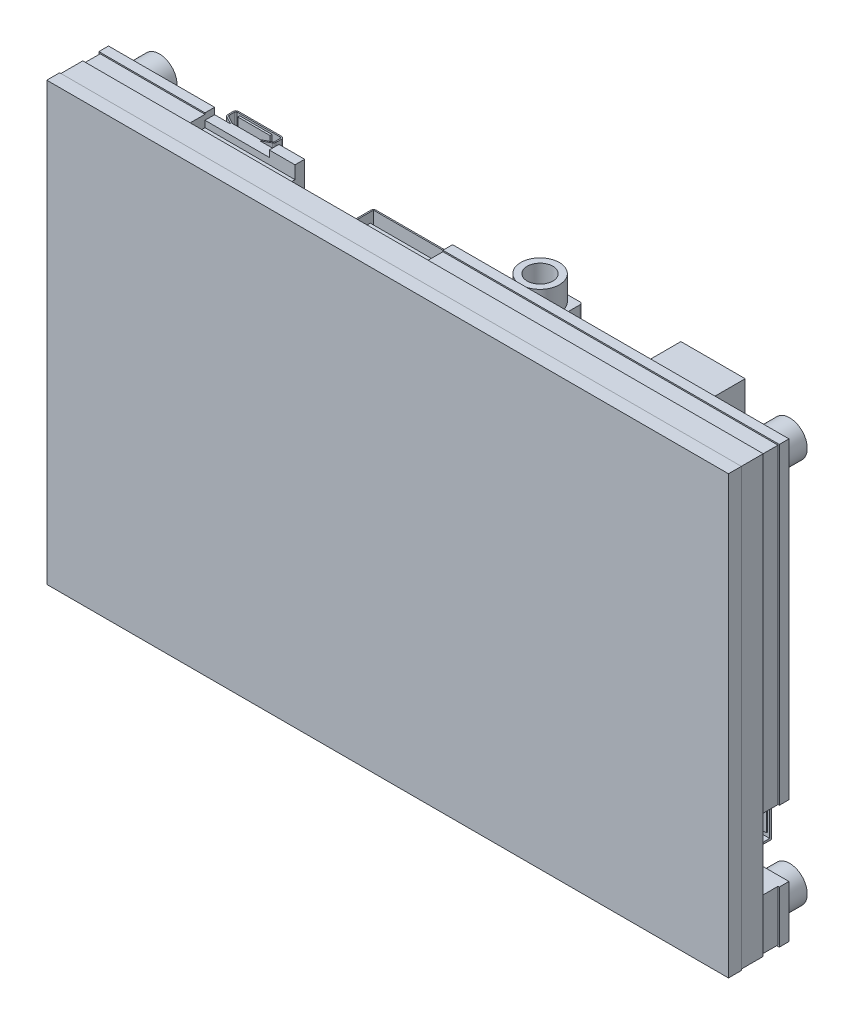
SolidWorks part; units mm, degrees
ref_plane "Front Plane" through (0, 0, 0) normal (0, 0, 1) x (1, 0, 0)
ref_plane "Top Plane" through (0, 0, 0) normal (0, 1, 0) x (1, 0, 0)
ref_plane "Right Plane" through (0, 0, 0) normal (1, 0, 0) x (0, 0, -1)
sketch "Esquisse1" plane through (0, 0, 0) normal (0, 0, 1) x (1, 0, 0)
  line L1 (-53, -33.95) -> (53, -33.95)
  line L2 (-53, -33.95) -> (-53, 33.95)
  line L3 (-53, 33.95) -> (53, 33.95)
  line L4 (53, -33.95) -> (53, 33.95)
  line L5 (-53, -33.95) -> (53, 33.95) construction
  line L6 (-53, 33.95) -> (53, -33.95) construction
  point P0 (0, 0)
  dimension "D1" = 106
  dimension "D2" = 67.9
extrude "Boss.-Extru.1" add sketch "Esquisse1" along normal blind 2
sketch "Esquisse2" plane through (0, 0, 0) normal (0, 0, -1) x (-1, 0, 0)
  line L16 (-52.9, 33.85) -> (-52.9, -33.85)
  line L17 (-52.9, -33.85) -> (52.9, -33.85)
  line L18 (52.9, -33.85) -> (52.9, 33.85)
  line L19 (52.9, 33.85) -> (-52.9, 33.85)
  line L20 (-52.9, 33.85) -> (-52.9, -33.85)
  line L21 (-52.9, -33.85) -> (52.9, -33.85)
  line L22 (52.9, -33.85) -> (52.9, 33.85)
  line L23 (52.9, 33.85) -> (-52.9, 33.85)
  dimension "D1" = 0.1
extrude "Boss.-Extru.2" add sketch "Esquisse2" along normal blind 3.5
sketch "Esquisse5" plane through (0, 0, -3.5) normal (0, 0, -1) x (-1, 0, 0)
  line L8 (52.7, 33.65) -> (-52.7, 33.65)
  line L9 (-52.7, 33.65) -> (-52.7, -33.65)
  line L10 (-52.7, -33.65) -> (52.7, -33.65)
  line L11 (52.7, -33.65) -> (52.7, 33.65)
  line L12 (52.7, 33.65) -> (-52.7, 33.65)
  line L13 (-52.7, 33.65) -> (-52.7, -33.65)
  line L14 (-52.7, -33.65) -> (52.7, -33.65)
  line L15 (52.7, -33.65) -> (52.7, 33.65)
  dimension "D1" = 0.2
extrude "Boss.-Extru.3" add sketch "Esquisse5" along normal blind 2.5
sketch "Esquisse6" plane through (0, 0, -6) normal (0, 0, -1) x (-1, 0, 0)
  line L0 (-0.6, 33.85) -> (-52.9, 33.85)
  line L2 (-0.6, 33.85) -> (-0.6, 25.85)
  line L3 (-0.6, 25.85) -> (22.4, 25.85)
  line L4 (52.9, 33.85) -> (-52.9, 33.85) construction
  line L5 (52.9, -33.85) -> (52.9, 33.85) construction
  line L6 (-52.9, 33.85) -> (-52.9, -33.85) construction
  line L7 (-52.9, -33.85) -> (52.9, -33.85) construction
  line L8 (52.9, -33.85) -> (52.9, 33.85)
  line L9 (52.9, 33.85) -> (36.4, 33.85)
  line L10 (-52.9, 33.85) -> (-52.9, -14.75)
  line L11 (-52.9, -33.85) -> (52.9, -33.85)
  line L12 (22.4, 33.85) -> (22.4, 25.85)
  line L13 (-52.9, -25.75) -> (-52.9, -33.85)
  line L14 (-52.9, -14.75) -> (-47.4, -14.75)
  line L16 (-52.9, -25.75) -> (-47.4, -25.75)
  line L17 (-47.4, -14.75) -> (-47.4, -25.75)
  line L18 (26.4, 33.85) -> (22.4, 33.85)
  line L20 (26.4, 33.85) -> (26.4, 32.85)
  line L21 (26.4, 32.85) -> (36.4, 32.85)
  line L22 (36.4, 33.85) -> (36.4, 32.85)
  dimension "D2" = 8
  dimension "D3" = 23
  dimension "D4" = 30.5
  dimension "D5" = 11
  dimension "D6" = 5.5
  dimension "D7" = 8.1
  dimension "D1" = 10
  dimension "D8" = 1
  dimension "D9" = 4
extrude "Boss.-Extru.4" add sketch "Esquisse6" along normal blind 1.5
sketch "Esquisse7" plane through (0, 0, -6) normal (0, 0, -1) x (-1, 0, 0)
  line L0 (-52.7, -25.75) -> (-47.4, -25.75) construction
  line L1 (-47.4, -25.75) -> (-47.4, -14.75) construction
  line L2 (-47.4, -14.75) -> (-52.7, -14.75) construction
  line L3 (-52.7, -14.75) -> (-52.7, -25.75) construction
  line L4 (-0.6, 33.65) -> (-0.6, 25.85) construction
  line L5 (-0.6, 25.85) -> (22.4, 25.85) construction
  line L6 (22.4, 25.85) -> (22.4, 33.65) construction
  line L7 (22.4, 33.65) -> (-0.6, 33.65) construction
  line L8 (-52.7, -25.75) -> (-47.4, -25.75)
  line L9 (-47.4, -25.75) -> (-47.4, -14.75)
  line L10 (-47.4, -14.75) -> (-52.7, -14.75)
  line L11 (-52.7, -14.75) -> (-52.7, -25.75)
  line L12 (-0.6, 33.65) -> (-0.6, 25.85)
  line L13 (-0.6, 25.85) -> (22.4, 25.85)
  line L14 (22.4, 25.85) -> (22.4, 31.85)
  line L15 (36.4, 33.65) -> (-0.6, 33.65)
  line L16 (36.4, 33.65) -> (36.4, 32.85) construction
  line L19 (22.4, 31.85) -> (36.4, 31.85)
  line L20 (36.4, 33.65) -> (36.4, 31.85)
  line L21 (22.4, 33.65) -> (22.4, 25.85) construction
  line L22 (52.7, 33.65) -> (-52.7, 33.65) construction
  line L23 (52.9, 33.85) -> (-52.9, 33.85) construction
  line L24 (36.4, 33.65) -> (26.4, 33.65) construction
  dimension "D1" = 2
extrude "Enlèv. mat.-Extru.1" cut sketch "Esquisse7" against normal up to surface (2.5 mm away)
sketch "Esquisse8" plane through (0, 0, -7.5) normal (0, 0, -1) x (-1, 0, 0)
  line L0 (-52.9, 33.85) -> (-52.9, -33.85) construction
  line L3 (52.9, 33.85) -> (-52.9, 33.85) construction
  circle A0 centre (-49, 30) radius 2.75
  circle A1 centre (49, 30) radius 2.75
  circle A2 centre (38.8, 22.9) radius 2.75
  circle A3 centre (-19.2, 22.9) radius 2.75
  circle A4 centre (-49, -30) radius 2.75
  circle A5 centre (-19.2, -27.1) radius 2.75
  circle A6 centre (38.8, -27.1) radius 2.75
  circle A7 centre (49, -30) radius 2.75
  circle A8 centre (-49, -30) radius 1.25
  circle A9 centre (-19.2, -27.1) radius 1.25
  circle A10 centre (38.8, -27.1) radius 1.25
  circle A11 centre (49, -30) radius 1.25
  circle A12 centre (49, 30) radius 1.25
  circle A13 centre (-19.2, 22.9) radius 1.25
  circle A14 centre (-49, 30) radius 1.25
  circle A15 centre (38.8, 22.9) radius 1.25
  dimension "D1" = 98
  dimension "D2" = 58
  dimension "D3" = 60
  dimension "D4" = 50
  dimension "D6" = 3.85
  dimension "D7" = 10.2
  dimension "D8" = 2.9
  dimension "D9" = 5.5
  dimension "D10" = 2.5
  dimension "D5" = 3.9
extrude "Boss.-Extru.5" add sketch "Esquisse8" along normal blind 4
sketch "Esquisse9" plane through (0, 0, -7.5) normal (0, 0, -1) x (-1, 0, 0)
  line L0 (-0.6, 33.85) -> (-52.9, 33.85) construction
  line L1 (-39.9, 32.35) -> (-29.9, 32.35)
  line L2 (-39.9, 32.35) -> (-39.9, 27.35)
  line L3 (-39.9, 27.35) -> (-29.9, 27.35)
  line L4 (-29.9, 32.35) -> (-29.9, 27.35)
  line L5 (-14.6, 29.85) -> (-7.6, 29.85)
  line L6 (-14.6, 29.85) -> (-14.6, 17.35)
  line L7 (-14.6, 17.35) -> (-7.6, 17.35)
  line L8 (-7.6, 29.85) -> (-7.6, 17.35)
  line L9 (2.9, 26.35) -> (17.9, 26.35)
  line L10 (2.9, 26.35) -> (2.9, 14.85)
  line L11 (2.9, 14.85) -> (17.9, 14.85)
  line L12 (17.9, 26.35) -> (17.9, 14.85)
  line L13 (-52.9, 33.85) -> (-52.9, -14.75) construction
  line L14 (-0.6, 25.85) -> (-0.6, 33.65) construction
  line L15 (22.4, 25.85) -> (-0.6, 25.85) construction
  line L16 (22.4, 31.85) -> (22.4, 25.85) construction
  line L17 (-39.6, 32.05) -> (-30.2, 32.05)
  line L18 (-30.2, 32.05) -> (-30.2, 27.65)
  line L19 (-39.6, 27.65) -> (-30.2, 27.65)
  line L20 (-39.6, 32.05) -> (-39.6, 27.65)
  dimension "D1" = 10
  dimension "D2" = 5
  dimension "D3" = 7
  dimension "D4" = 12.5
  dimension "D5" = 15
  dimension "D6" = 11.5
  dimension "D7" = 1.5
  dimension "D8" = 13
  dimension "D9" = 7
  dimension "D10" = 4
  dimension "D11" = 0.5
  dimension "D12" = 4.5
  dimension "D13" = 0.3
extrude "Boss.-Extru.6" add sketch "Esquisse9" along normal blind 6.2
fillet "Congé1" radius 0.4 4 edges at (14.6, 23.6, -13.7) (7.6, 23.6, -13.7) (-2.9, 20.6, -13.7) (-17.9, 20.6, -13.7)
sketch "Esquisse10" plane through (0, 29.85, 0) normal (0, 1, 0) x (1, 0, 0)
  line L0 (14.6, 13.3) -> (14.6, 7.5) construction
  line L1 (8, 13.7) -> (14.2, 13.7) construction
  circle A0 centre (11.1, 10.6) radius 3
  circle A1 centre (11.1, 10.6) radius 2
  dimension "D1" = 6
  dimension "D2" = 3.5
  dimension "D4" = 4
  dimension "D3" = 3.1
extrude "Boss.-Extru.7" add sketch "Esquisse10" along normal blind 3.8
sketch "Esquisse11" plane through (0, 26.35, 0) normal (0, 1, 0) x (1, 0, 0)
  line L0 (-17.7, 13.5) -> (-3.1, 13.5)
  line L1 (-3.1, 13.5) -> (-3.1, 11)
  line L2 (-3.1, 11) -> (-5.4, 7.8)
  line L3 (-5.4, 7.8) -> (-15.4, 7.8)
  line L4 (-15.4, 7.8) -> (-17.7, 11)
  line L5 (-17.7, 11) -> (-17.7, 13.5)
  line L6 (-17.5, 13.7) -> (-3.3, 13.7) construction
  line L7 (-17.9, 13.3) -> (-17.9, 7.5) construction
  line L8 (-2.9, 13.3) -> (-2.9, 7.5) construction
  line L9 (-17.9, 7.5) -> (-2.9, 7.5) construction
  line L11 (-16.2, 11.5) -> (-4.6, 11.5)
  line L12 (-16.2, 11.5) -> (-16.2, 10.5)
  line L13 (-16.2, 10.5) -> (-4.6, 10.5)
  line L14 (-4.6, 11.5) -> (-4.6, 10.5)
  point P6 (-16.2, 11)
  dimension "D1" = 0.2
  dimension "D2" = 0.2
  dimension "D3" = 0.2
  dimension "D4" = 0.3
  dimension "D5" = 2.5
  dimension "D6" = 10
  dimension "D7" = 1.5
  dimension "D8" = 1.5
  dimension "D9" = 2
  dimension "D10" = 1
extrude "Enlèv. mat.-Extru.2" cut sketch "Esquisse11" against normal blind 7
sketch "Esquisse12" plane through (0, 0, -7.5) normal (0, 0, -1) x (-1, 0, 0)
  line L0 (52.9, -33.85) -> (52.9, 33.85) construction
  line L1 (50.9, 26.85) -> (47.9, 26.85)
  line L2 (50.9, 26.85) -> (50.9, 19.85)
  line L3 (50.9, 19.85) -> (47.9, 19.85)
  line L4 (47.9, 26.85) -> (47.9, 19.85)
  line L5 (52.9, 33.85) -> (36.4, 33.85) construction
  dimension "D1" = 7
  dimension "D2" = 3
  dimension "D3" = 2
  dimension "D4" = 7
extrude "Boss.-Extru.8" add sketch "Esquisse12" along normal blind 3.5
pattern_linear "Répétition linéaire1" count 5 spacing 11.7 along (0, -1, 0) of "Boss.-Extru.8"
sketch "Esquisse13" plane through (0, 32.85, 0) normal (0, 1, 0) x (1, 0, 0)
  line L0 (-35.4, 9.8) -> (-27.9, 9.8)
  line L1 (-27.9, 9.8) -> (-27.9, 8.3)
  line L2 (-27.9, 8.3) -> (-29.4, 7.5)
  line L3 (-36.4, 7.5) -> (-26.4, 7.5) construction
  line L4 (-29.4, 7.5) -> (-33.9, 7.5)
  line L5 (-33.9, 7.5) -> (-35.4, 8.3)
  line L6 (-35.4, 8.3) -> (-35.4, 9.8)
other "Esquisse au crayon1" parameters "D1"=2.3993, "D2"=5.3657, "D3"=6.1031, "D4"=1.6648, "D5"=7.5
extrude "Boss.-Extru.9" add sketch "Esquisse13" against normal blind 5.5
fillet "Congé2" radius 0.4 4 edges at (-35.4, 30.1, -8.3) (-27.9, 30.1, -8.3) (-27.9, 30.1, -9.8) (-35.4, 30.1, -9.8)
sketch "Esquisse15" plane through (0, 32.85, 0) normal (0, 1, 0) x (1, 0, 0)
  line L10 (-33.85, 7.7) -> (-29.45, 7.7)
  line L11 (-29.4, 7.5) -> (-26.4, 7.5) construction
  line L13 (-34.3, 9.3) -> (-29.3, 9.3)
  line L14 (-34.3, 9.3) -> (-34.3, 9)
  line L15 (-34.3, 9) -> (-29.3, 9)
  line L16 (-29.3, 9.3) -> (-29.3, 9)
  line L20 (-35.2, 9.4) -> (-35.2, 8.54)
  line L21 (-35.0941, 8.3635) -> (-33.1, 7.3)
  line L22 (-33.1, 7.3) -> (-36.2, 7.3)
  line L23 (-36.2, 7.3) -> (-36.2, 6.2)
  line L24 (-36.2, 6.2) -> (-26.6, 6.2)
  line L25 (-26.6, 6.2) -> (-26.6, 7.3)
  line L26 (-26.6, 7.3) -> (-30.2, 7.3)
  line L27 (-30.2, 7.3) -> (-28.2059, 8.3635)
  line L28 (-28.1, 8.54) -> (-28.1, 9.4)
  line L29 (-28.3, 9.6) -> (-35, 9.6)
  line L30 (-35.2, 9.4) -> (-35.2, 8.54)
  line L31 (-35.0941, 8.3635) -> (-33.85, 7.7)
  line L37 (-29.45, 7.7) -> (-28.2059, 8.3635)
  line L38 (-28.1, 8.54) -> (-28.1, 9.4)
  line L39 (-28.3, 9.6) -> (-35, 9.6)
  arc A8 (-35.2, 8.54) -> (-35.0941, 8.3635) centre (-35, 8.54) ccw
  arc A9 (-28.2059, 8.3635) -> (-28.1, 8.54) centre (-28.3, 8.54) ccw
  arc A10 (-28.1, 9.4) -> (-28.3, 9.6) centre (-28.3, 9.4) ccw
  arc A11 (-35, 9.6) -> (-35.2, 9.4) centre (-35, 9.4) ccw
  arc A12 (-35.2, 8.54) -> (-35.0941, 8.3635) centre (-35, 8.54) ccw
  arc A13 (-28.2059, 8.3635) -> (-28.1, 8.54) centre (-28.3, 8.54) ccw
  arc A14 (-28.1, 9.4) -> (-28.3, 9.6) centre (-28.3, 9.4) ccw
  arc A15 (-35, 9.6) -> (-35.2, 9.4) centre (-35, 9.4) ccw
  point P8 (-29.3, 9.15)
  dimension "D2" = 0.2
  dimension "D3" = 5
  dimension "D4" = 0.3
  dimension "D5" = 1.2
  dimension "D6" = 0.3
  dimension "D1" = 0.2
extrude "Enlèv. mat.-Extru.3" cut sketch "Esquisse15" against normal blind 4
sketch "Esquisse16" plane through (47.4, 0, 0) normal (1, 0, 0) x (0, 0, -1)
  line L0 (9.8, -16.25) -> (9.8, -23.75)
  line L1 (9.8, -23.75) -> (8.3, -23.75)
  line L2 (8.3, -23.75) -> (7.5, -22.25)
  line L3 (7.5, -22.25) -> (7.5, -17.75)
  line L4 (7.5, -17.75) -> (8.3, -16.25)
  line L5 (8.3, -16.25) -> (9.8, -16.25)
  line L6 (7.5, -14.75) -> (7.5, -25.75) construction
  line L7 (7.5, -14.75) -> (3.5, -14.75) construction
  dimension "D1" = 4.5
  dimension "D2" = 7.5
  dimension "D3" = 1.5
  dimension "D4" = 2.3
  dimension "D5" = 3
extrude "Boss.-Extru.10" add sketch "Esquisse16" along normal blind 0.5 and the other way blind 5
sketch "Esquisse17" plane through (47.9, 0, 0) normal (1, 0, 0) x (0, 0, -1)
  line L7 (9.2, -17.45) -> (9, -17.45)
  line L8 (9.2, -17.45) -> (9.2, -22.45)
  line L9 (9.2, -22.45) -> (9, -22.45)
  line L10 (9, -17.45) -> (9, -22.45)
  line L12 (9.5, -16.55) -> (8.48, -16.55)
  line L13 (8.48, -16.55) -> (7.8, -17.825)
  line L14 (7.8, -17.825) -> (7.8, -22.175)
  line L15 (7.8, -22.175) -> (8.48, -23.45)
  line L16 (8.48, -23.45) -> (9.5, -23.45)
  line L17 (9.5, -23.45) -> (9.5, -16.55)
  line L18 (9.5, -16.55) -> (8.48, -16.55)
  line L19 (8.48, -16.55) -> (7.8, -17.825)
  line L20 (7.8, -17.825) -> (7.8, -22.175)
  line L21 (7.8, -22.175) -> (8.48, -23.45)
  line L22 (8.48, -23.45) -> (9.5, -23.45)
  line L23 (9.5, -23.45) -> (9.5, -16.55)
  dimension "D2" = 5
  dimension "D3" = 1
  dimension "D4" = 0.3
  dimension "D5" = 0.2
  dimension "D1" = 0.3
extrude "Enlèv. mat.-Extru.4" cut sketch "Esquisse17" against normal blind 4
equation "\"é\"=3.51382"
